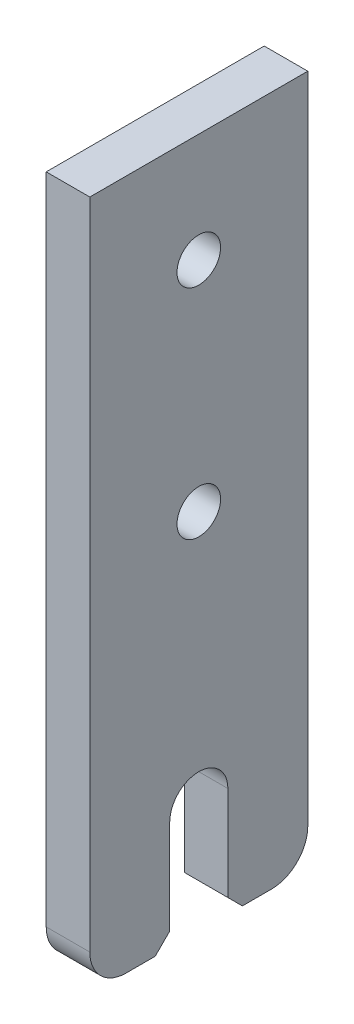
SolidWorks part; units mm, degrees
ref_plane "Alzado" through (0, 0, 0) normal (0, 0, 1) x (1, 0, 0)
ref_plane "Planta" through (0, 0, 0) normal (0, 1, 0) x (1, 0, 0)
ref_plane "Vista lateral" through (0, 0, 0) normal (1, 0, 0) x (0, 0, -1)
sketch "Croquis1" plane through (0, 0, 0) normal (1, 0, 0) x (0, 0, -1)
  line L1 (-15, -47.5) -> (15, -47.5)
  line L2 (-15, -47.5) -> (-15, 47.5)
  line L3 (-15, 47.5) -> (15, 47.5)
  line L4 (15, -47.5) -> (15, 47.5)
  line L5 (-15, -47.5) -> (15, 47.5) construction
  line L6 (-15, 47.5) -> (15, -47.5) construction
  point P0 (0, 0)
  dimension "D1" = 30
  dimension "D2" = 95
extrude "Saliente-Extruir1" add sketch "Croquis1" along normal mid plane 6
sketch "Croquis2" plane through (3, 0, 0) normal (1, 0, 0) x (0, 0, -1)
  line L0 (-4, -32.5) -> (-4, -47.5)
  line L1 (-15, -47.5) -> (15, -47.5) construction
  line L2 (-4, -47.5) -> (4, -47.5)
  line L3 (4, -47.5) -> (4, -32.5)
  line L4 (0, 0) -> (0, -32.5) construction
  arc A0 (4, -32.5) -> (-4, -32.5) centre (0, -32.5) ccw
  dimension "D1" = 8
  dimension "D2" = 15
extrude "Cortar-Extruir1" cut sketch "Croquis2" against normal through all
sketch "Croquis3" plane through (3, 0, 0) normal (1, 0, 0) x (0, 0, -1)
  line L0 (0, 47.5) -> (0, 32.5) construction
  line L1 (15, 47.5) -> (-15, 47.5) construction
  line L2 (0, 32.5) -> (0, 2.5) construction
  circle A0 centre (0, 32.5) radius 3
  circle A1 centre (0, 2.5) radius 3
  dimension "D1" = 6
  dimension "D2" = 15
  dimension "D3" = 30
extrude "Cortar-Extruir2" cut sketch "Croquis3" against normal through all
fillet "Redondeo1" radius 5 2 edges at (0, -47.5, -15) (0, -47.5, 15)
chamfer "Chaflán1" distance 2 angle 45 2 edges at (0, -47.5, -4) (0, -47.5, 4)
